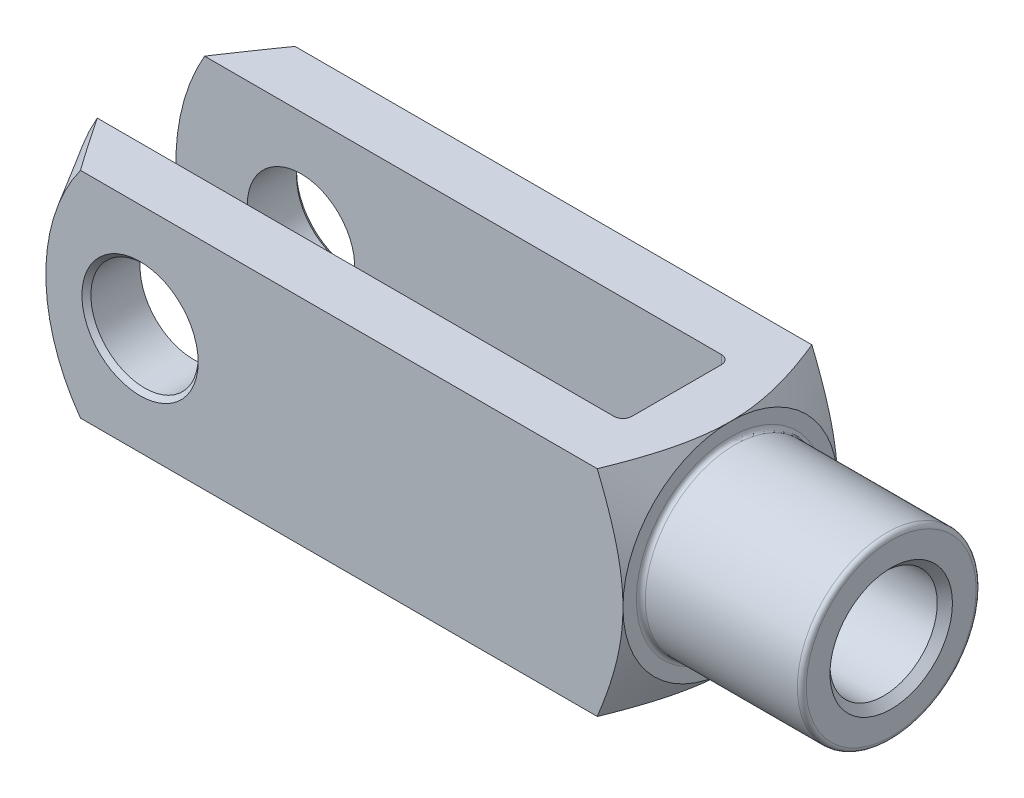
SolidWorks part; units mm, degrees
ref_plane "Front Plane" through (0, 0, 0) normal (0, 0, 1) x (1, 0, 0)
ref_plane "Top Plane" through (0, 0, 0) normal (0, 1, 0) x (1, 0, 0)
ref_plane "Right Plane" through (0, 0, 0) normal (1, 0, 0) x (0, 0, -1)
sketch "Sketch1" plane through (0, 0, 0) normal (1, 0, 0) x (0, 0, -1)
  line L0 (0, 0) -> (0, 50000) construction
  line L1 (0, 0) -> (50000, 0) construction
  line L2 (-12, -12) -> (-12, 12)
  line L3 (-12, 12) -> (12, 12)
  line L4 (12, -12) -> (12, 12)
  line L5 (-12, -12) -> (12, -12)
  point P9 (0, 12)
  point P11 (12, 0)
  point P12 (-12, 0)
  dimension "D1" = 24
  dimension "D2" = 24
extrude "Extrude1" add sketch "Sketch1" against normal blind 86
sketch "Sketch2" plane through (0, 0, 0) normal (1, 0, 0) x (0, 0, -1)
  circle A0 centre (0, 0) radius 10
  circle A1 centre (0, 0) radius 20
  dimension "D1" = 20
  dimension "D2" = 40
extrude "Extrude2" cut sketch "Sketch2" against normal blind 18
sketch "Sketch3" plane through (0, 0, 12) normal (0, 0, 1) x (1, 0, 0)
  circle A0 centre (-72, 0) radius 6
  dimension "D1" = 12
  dimension "D2" = 72
extrude "Extrude3" cut sketch "Sketch3" against normal through all
sketch "Sketch4" plane through (0, 12, 0) normal (0, 1, 0) x (1, 0, 0)
  line L0 (0, 0) -> (-50000, 0) construction
  line L1 (-86, -6) -> (-86, 6)
  line L2 (-86, 12) -> (-86, -12) construction
  line L3 (-86, 6) -> (-24, 6)
  line L4 (-24, 6) -> (-24, -6)
  line L5 (-72, 12) -> (-72, -12) construction
  line L6 (-86, -6) -> (-24, -6)
  point P7 (-72, 0)
  point P13 (-24, 0)
  point P14 (-86, 0)
  dimension "D1" = 48
  dimension "D2" = 12
extrude "Extrude4" cut sketch "Sketch4" against normal through all
fillet "Fillet1" radius 1 2 edges at (-24, 0, 6) (-24, 0, -6)
fillet "Fillet2" radius 0.5 2 edges at (0, 0, -10) (-18, 0, -10)
chamfer "Chamfer2" distance 0.5 angle 45 2 edges at (-66, 0, -12) (-66, 0, 12)
sketch "Sketch6" plane through (0, 0, 0) normal (0, 0, 1) x (1, 0, 0)
  line L0 (-18, -12) -> (-18, -24)
  line L1 (-18, -24) -> (-24.9282, -24)
  line L2 (-24.9282, -24) -> (-18, -12)
  dimension "D1" = 30
  dimension "D2" = 24
revolve "Cut-Revolve1" cut sketch "Sketch6" angle 360 about axis through (-18, 0, 0) along (1, 0, 0)
sketch "Sketch7" plane through (0, 0, 0) normal (0, 1, 0) x (1, 0, 0)
  line L0 (-82.5359, -12) -> (-86, -6)
  line L1 (-86, 6) -> (-82.5359, 12)
  line L2 (-82.5359, 12) -> (-110, 12)
  line L3 (-86, 6) -> (-86, -6)
  line L4 (-110, 12) -> (-110, -12)
  line L5 (-110, -12) -> (-82.5359, -12)
  line L6 (-86, 12) -> (-20.8698, 12) construction
  line L7 (-86, -12) -> (-20.8698, -12) construction
  line L8 (-62, 0.6162) -> (-62, 50000.6162) construction
  dimension "D1" = 120
  dimension "D2" = 24
  dimension "D3" = 24
revolve "Cut-Revolve2" cut sketch "Sketch7" angle 180 about L8
sketch "Sketch8" plane through (0, 0, 0) normal (1, 0, 0) x (0, 0, -1)
  circle A0 centre (0, 0) radius 6
  dimension "D1" = 12
extrude "Extrude5" cut sketch "Sketch8" against normal through all
chamfer "Chamfer3" distance 0.85 angle 45 1 edges at (0, 0, -6)
equation "\"D2@Sketch1\" = \"D1@Sketch1\""
equation "\"D2@Sketch2\" = \"D1@Sketch2\"*2"
equation "\"D2@Sketch6\" = \"D1@Sketch1\""
equation "\"D2@Sketch7\" = \"D1@Sketch1\""
equation "\"D3@Sketch7\" = \"D1@Sketch1\""
